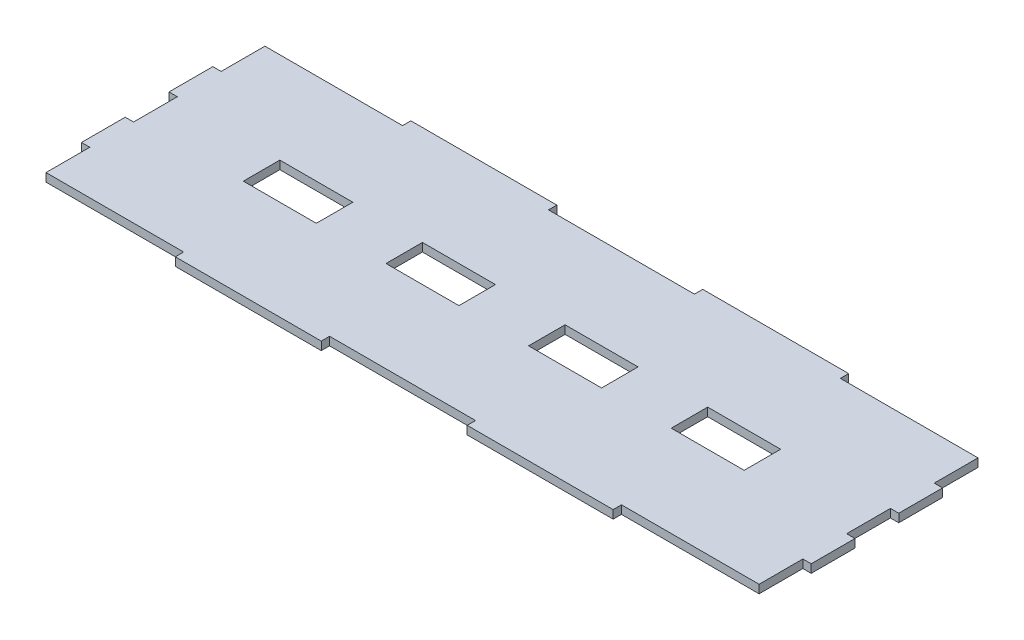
SolidWorks part; units mm, degrees
ref_plane "Alzado" through (0, 0, 0) normal (0, 0, 1) x (1, 0, 0)
ref_plane "Planta" through (0, 0, 0) normal (0, 1, 0) x (1, 0, 0)
ref_plane "Vista lateral" through (0, 0, 0) normal (1, 0, 0) x (0, 0, -1)
sketch "Sketch1" plane through (0, 0, 0) normal (0, 1, 0) x (1, 0, 0)
  line L17 (-20, 30) -> (20, 30)
  line L32 (20, -30) -> (-20, -30)
  line L40 (-100, 30) -> (-60, 30)
  line L41 (-60, 30) -> (-60, 32.28)
  line L42 (-60, 32.28) -> (-20, 32.28)
  line L43 (-20, 32.28) -> (-20, 30)
  line L44 (20, 30) -> (20, 32.28)
  line L45 (20, 32.28) -> (60, 32.28)
  line L46 (60, 32.28) -> (60, 30)
  line L48 (-60, -30) -> (-60, -32.28)
  line L49 (-60, -32.28) -> (-20, -32.28)
  line L50 (-20, -32.28) -> (-20, -30)
  line L51 (20, -30) -> (20, -32.28)
  line L52 (20, -32.28) -> (60, -32.28)
  line L53 (60, -32.28) -> (60, -30)
  line L54 (-100, 30) -> (-97.72, 30)
  line L55 (-97.72, 30) -> (-97.72, 18)
  line L56 (-97.72, 18) -> (-100, 18)
  line L57 (-100, 6) -> (-97.72, 6)
  line L58 (-97.72, 6) -> (-97.72, -6)
  line L59 (-97.72, -6) -> (-100, -6)
  line L60 (-100, -6) -> (-100, -18)
  line L61 (-100, -18) -> (-97.72, -18)
  line L62 (-97.72, -18) -> (-97.72, -30)
  line L64 (97.72, 30) -> (97.72, 18)
  line L65 (97.72, 18) -> (100, 18)
  line L66 (100, 6) -> (97.72, 6)
  line L67 (97.72, 6) -> (97.72, -6)
  line L68 (97.72, -6) -> (100, -6)
  line L69 (100, -18) -> (97.72, -18)
  line L70 (97.72, -18) -> (97.72, -30)
  line L71 (60, 30) -> (97.72, 30)
  line L72 (100, 18) -> (100, 5.3423)
  line L73 (100, -6) -> (100, -18)
  line L74 (60, -30) -> (97.72, -30)
  line L75 (-97.72, -30) -> (-60, -30)
  line L76 (-100, 18) -> (-100, 6)
  point P0 (0, 0)
  point P5 (-60, 30)
  point P6 (-20, 30)
  point P8 (20, 30)
  point P9 (60, 30)
  point P10 (-60, -30)
  point P11 (-20, -30)
  point P12 (20, -30)
  point P13 (60, -30)
  point P14 (-100, 18)
  point P15 (-100, 6)
  point P16 (-100, -6)
  point P17 (-100, -18)
  point P18 (100, 18)
  point P19 (100, 6)
  point P20 (100, -6)
  point P21 (100, -18)
extrude "Boss-Extrude3" add sketch "Sketch1" along normal blind 2.28 contours L56 L76 L57 L58 L59 L60 L61 L62 L75 L48 L49 L50 L32 L51 L52 L53 L74 L70 L69 L73 L68 L67 L66 L72 L65 L64 L71 L46 L45 L44 L17 L43 L42 L41 L40 L55
sketch "Sketch2" plane through (0, 2.28, 0) normal (0, 1, 0) x (1, 0, 0)
  line L0 (-97.72, 0) -> (97.72, 0)
  line L1 (-97.72, 6) -> (-97.72, -6) construction
  line L2 (97.72, 6) -> (97.72, -6) construction
  line L4 (-68.632, 5) -> (-48.632, 5)
  line L5 (-68.632, 5) -> (-68.632, -5)
  line L6 (-68.632, -5) -> (-48.632, -5)
  line L7 (-48.632, 5) -> (-48.632, -5)
  line L8 (-68.632, 5) -> (-48.632, -5) construction
  line L9 (-68.632, -5) -> (-48.632, 5) construction
  line L10 (-29.544, 5) -> (-9.544, 5)
  line L11 (-29.544, 5) -> (-29.544, -5)
  line L12 (-29.544, -5) -> (-9.544, -5)
  line L13 (-9.544, 5) -> (-9.544, -5)
  line L14 (-29.544, 5) -> (-9.544, -5) construction
  line L15 (-29.544, -5) -> (-9.544, 5) construction
  line L16 (9.544, 5) -> (29.544, 5)
  line L17 (9.544, 5) -> (9.544, -5)
  line L18 (9.544, -5) -> (29.544, -5)
  line L19 (29.544, 5) -> (29.544, -5)
  line L20 (9.544, 5) -> (29.544, -5) construction
  line L21 (9.544, -5) -> (29.544, 5) construction
  line L22 (48.632, 5) -> (68.632, 5)
  line L23 (48.632, 5) -> (48.632, -5)
  line L24 (48.632, -5) -> (68.632, -5)
  line L25 (68.632, 5) -> (68.632, -5)
  line L26 (48.632, 5) -> (68.632, -5) construction
  line L27 (48.632, -5) -> (68.632, 5) construction
  point P6 (-58.632, 0)
  point P7 (-19.544, 0)
  point P8 (19.544, 0)
  point P9 (58.632, 0)
  point P10 (-58.632, 0)
  point P15 (-19.544, 0)
  point P20 (19.544, 0)
  point P25 (58.632, 0)
extrude "Cut-Extrude1" cut sketch "Sketch2" against normal blind 10 contours L25 L0 L23 L24 | L25 L22 L23 L0 | L19 L0 L17 L18 | L19 L16 L17 L0 | L13 L0 L11 L12 | L13 L10 L11 L0 | L7 L0 L5 L6 | L7 L4 L5 L0
equation "\"largo\"= 200"
equation "\"ancho\"= 60mm"
equation "\"madera\"= 2.28mm"
equation "\"cables\"= 20mm"
equation "\"cable2\"= 10mm"
equation "\"D1@Sketch2\"=\"cables\""
equation "\"D2@Sketch2\"=\"cable2\""
equation "\"D3@Sketch2\"=\"cables\""
equation "\"D4@Sketch2\"=\"cable2\""
equation "\"D5@Sketch2\"=\"cables\""
equation "\"D6@Sketch2\"=\"cable2\""
equation "\"D7@Sketch2\"=\"cables\""
equation "\"D8@Sketch2\"=\"cable2\""
